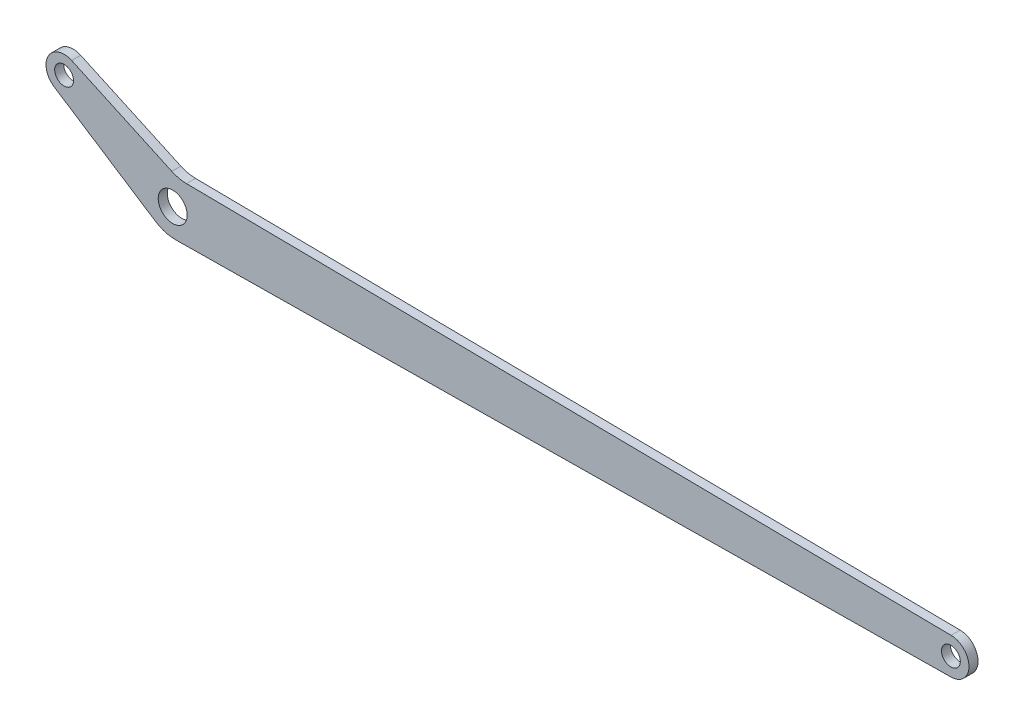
SolidWorks part; units mm, degrees
ref_plane "Front" through (0, 0, 0) normal (0, 0, 1) x (1, 0, 0)
ref_plane "Top" through (0, 0, 0) normal (0, 1, 0) x (1, 0, 0)
ref_plane "Right" through (0, 0, 0) normal (1, 0, 0) x (0, 0, -1)
sketch "Esquisse1" plane through (0, 0, 0) normal (0, 0, 1) x (1, 0, 0)
  line L0 (0, 0) -> (-215, 0) construction
  line L1 (-217.1816, -7.5259) -> (0.0581, -4.9997)
  line L2 (-247.7231, 12.3066) -> (-217.1816, -7.5259)
  line L3 (-242.9167, 21.0453) -> (-213.3217, 7.481)
  line L4 (-213.3217, 7.481) -> (0.0581, 4.9997)
  circle A0 centre (0, 0) radius 2.6
  arc A1 (0.0581, -4.9997) -> (0.0581, 4.9997) centre (0, 0) ccw
  circle A2 centre (-215, 0) radius 4
  arc A3 (-242.9167, 21.0453) -> (-247.7231, 12.3066) centre (-245, 16.5) ccw
  circle A4 centre (-245, 16.5) radius 2.6
  circle A5 centre (-215, 0) radius 7.5 construction
  dimension "D2" = 5.2
  dimension "D3" = 10
  dimension "D4" = 8
  dimension "D5" = 10
  dimension "D8" = 5.2
  dimension "D9" = 15
  dimension "D1" = 215
  dimension "D6" = 16.5
  dimension "D7" = 30
extrude "Boss.-Extru.1" add sketch "Esquisse1" along normal blind 2.5
fillet "Congé1" radius 10 1 edges at (-213.3217, 7.481, 1.25)
fillet "Congé2" radius 10 1 edges at (-217.1816, -7.5259, 1.25)
sketch "Esquisse2" plane through (0, 0, 0) normal (0, 0, -1) x (-1, 0, 0)
  point P0 (245, 16.5)
  point P1 (215, 0)
  point P3 (0, 0)
sketch "Esquisse3" plane through (0, 0, 2.5) normal (0, 0, 1) x (1, 0, 0)
  point P0 (-245, 16.5)
  point P2 (-215, 0)
  point P4 (0, 0)
